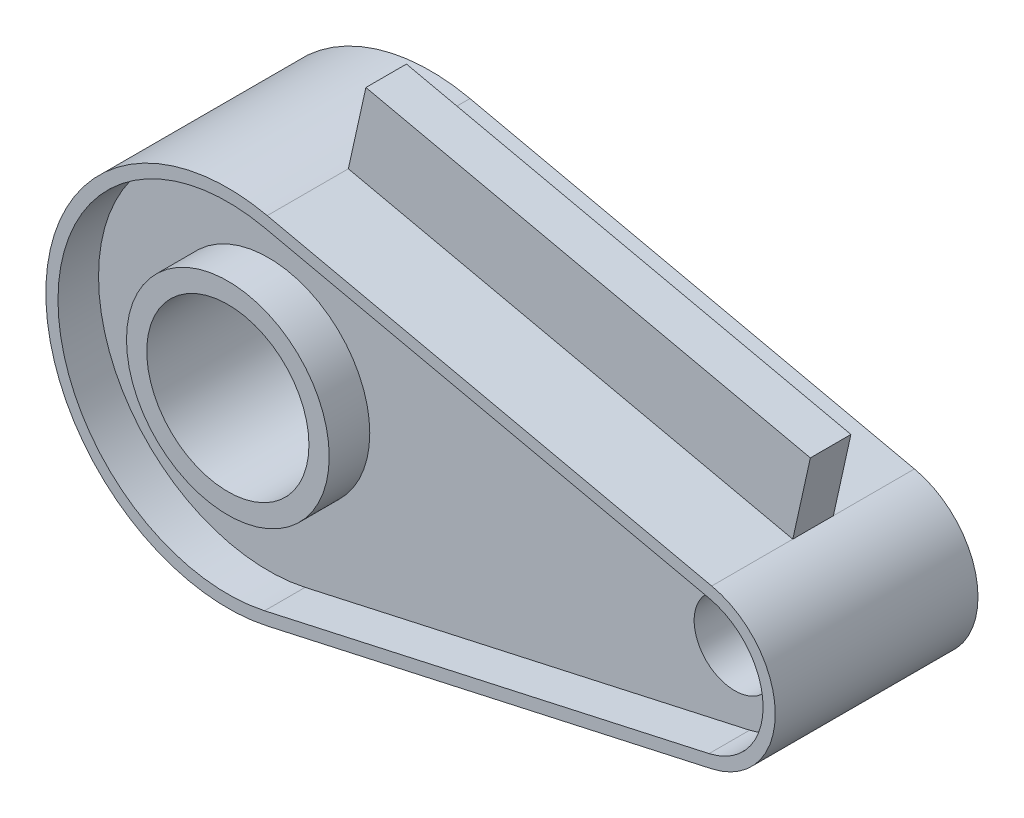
SolidWorks part; units mm, degrees
ref_plane "Front Plane" through (0, 0, 0) normal (0, 0, 1) x (1, 0, 0)
ref_plane "Top Plane" through (0, 0, 0) normal (0, 1, 0) x (1, 0, 0)
ref_plane "Right Plane" through (0, 0, 0) normal (1, 0, 0) x (0, 0, -1)
sketch "Sketch1" plane through (0, 0, 0) normal (0, 0, 1) x (1, 0, 0)
  line L0 (4.3288, -19.5259) -> (-105.2839, -43.8265)
  line L1 (-105.2839, 43.8265) -> (4.3288, 19.5259)
  line L2 (0, 0) -> (-184.5789, 0) construction
  arc A0 (-105.2839, -43.8265) -> (-105.2839, 43.8265) centre (-115, 0) cw
  arc A1 (4.3288, 19.5259) -> (4.3288, -19.5259) centre (0, 0) cw
  circle A2 centre (-115, 0) radius 20
  circle A3 centre (0, 0) radius 10
  dimension "D1" = 20
  dimension "D2" = 20
  dimension "D5" = 40
  dimension "D3" = 115
  dimension "D4" = 25
extrude "Extrude1" add sketch "Sketch1" along normal mid plane 50
sketch "Sketch3" plane through (0, 0, 25) normal (0, 0, 1) x (1, 0, 0)
  line L4 (3.6795, 16.597) -> (-105.9332, 40.8976)
  line L5 (-105.9332, -40.8976) -> (3.6795, -16.597)
  line L6 (3.6795, 16.597) -> (-105.9332, 40.8976)
  line L7 (-105.9332, -40.8976) -> (3.6795, -16.597)
  circle A3 centre (-115, 0) radius 25
  circle A4 centre (-115, 0) radius 25
  arc A8 (3.6795, -16.597) -> (3.6795, 16.597) centre (0, 0) ccw
  arc A9 (-105.9332, 40.8976) -> (-105.9332, -40.8976) centre (-115, 0) ccw
  arc A10 (3.6795, -16.597) -> (3.6795, 16.597) centre (0, 0) ccw
  arc A11 (-105.9332, 40.8976) -> (-105.9332, -40.8976) centre (-115, 0) ccw
  dimension "D1" = 5
  dimension "D2" = 3
extrude "Cut-Extrude3" cut sketch "Sketch3" against normal blind 10
sketch "Sketch4" plane through (4.3288, 19.5259, 0) normal (0.2164, 0.9763, 0) x (-0.9763, 0.2164, 0)
  line L0 (112.274, 0) -> (0, 0)
  line L1 (112.274, 25) -> (112.274, -25) construction
  line L2 (0, 25) -> (0, -25) construction
extrude "Extrude-Thin1" add sketch "Sketch4" along normal blind 20 thin
